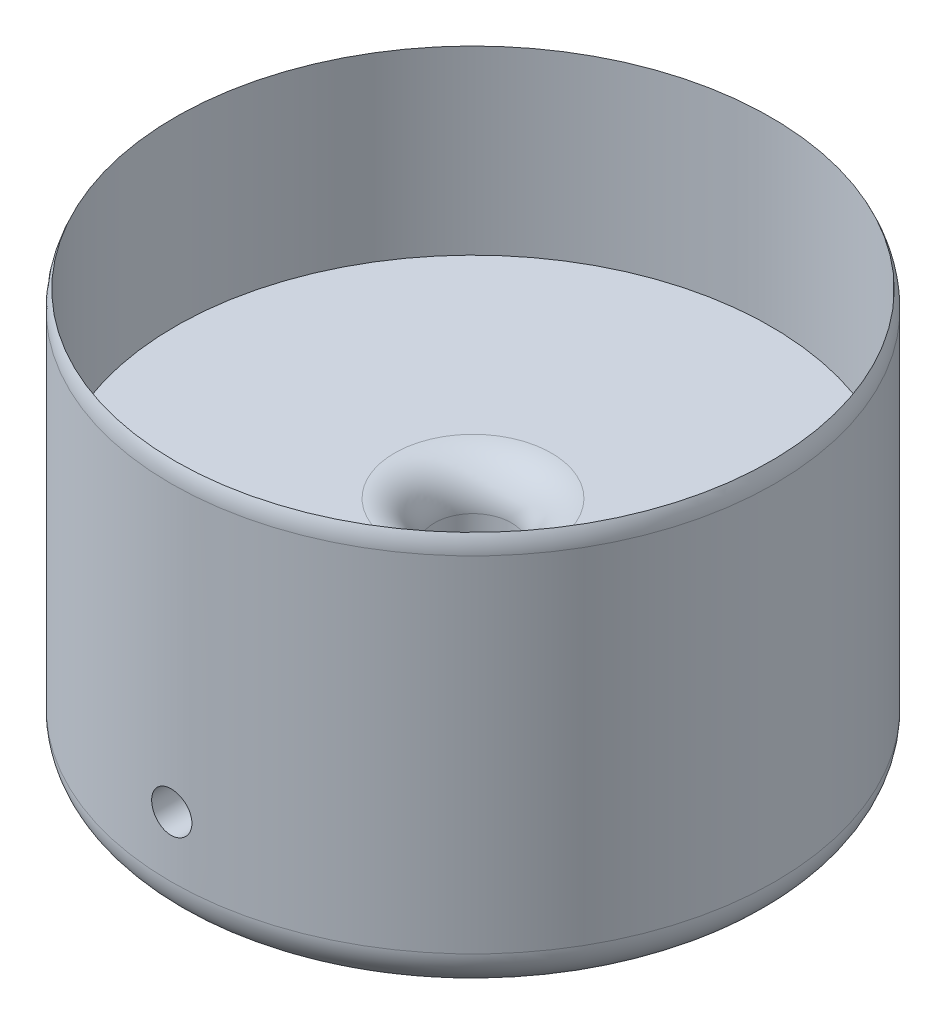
SolidWorks part; units mm, degrees
ref_plane "Alzado" through (0, 0, 0) normal (0, 0, 1) x (1, 0, 0)
ref_plane "Planta" through (0, 0, 0) normal (0, 1, 0) x (1, 0, 0)
ref_plane "Vista lateral" through (0, 0, 0) normal (1, 0, 0) x (0, 0, -1)
sketch "Croquis1" plane through (0, 0, 0) normal (0, 1, 0) x (1, 0, 0)
  circle A0 centre (0, 0) radius 75
  dimension "D1" = 150
extrude "Saliente-Extruir1" add sketch "Croquis1" along normal blind 100
sketch "Croquis2" plane through (0, 100, 0) normal (0, 1, 0) x (1, 0, 0)
  circle A0 centre (0, 0) radius 74
  dimension "D1" = 148
extrude "Cortar-Extruir1" cut sketch "Croquis2" against normal blind 45
sketch "Croquis3" plane through (0, 0, 0) normal (0, -1, 0) x (1, 0, 0)
  circle A0 centre (0, 0) radius 10
  dimension "D1" = 20
extrude "Saliente-Extruir2" add sketch "Croquis3" along normal blind 20
sketch "Croquis4" plane through (0, -20, 0) normal (0, -1, 0) x (1, 0, 0)
  circle A0 centre (0, 0) radius 9.5
  dimension "D1" = 19
extrude "Cortar-Extruir2" cut sketch "Croquis4" against normal blind 110
fillet "Redondeo3" radius 20 1 edges at (0, 0, 10)
fillet "Redondeo4" radius 10 1 edges at (0, 100, 75)
sketch3d "Croquis3D1"
  point P0 (-8.3268, 26.8479, 74.5363)
ref_plane "Plano1" through (0, 0, 74.5363) normal (0, 0, 1) x (1, 0, 0)
sketch "Croquis5" plane through (0, 0, 74.5363) normal (0, 0, 1) x (1, 0, 0)
  circle A0 centre (0, 25) radius 5
  dimension "D1" = 10
  dimension "D2" = 25
fillet "Redondeo5" radius 10 1 edges at (0, 0, 75)
fillet "Redondeo6" radius 10 1 edges at (0, 55, 9.5)
extrude "Cortar-Extruir4" cut sketch "Croquis5" against normal through all both and the other way through all
